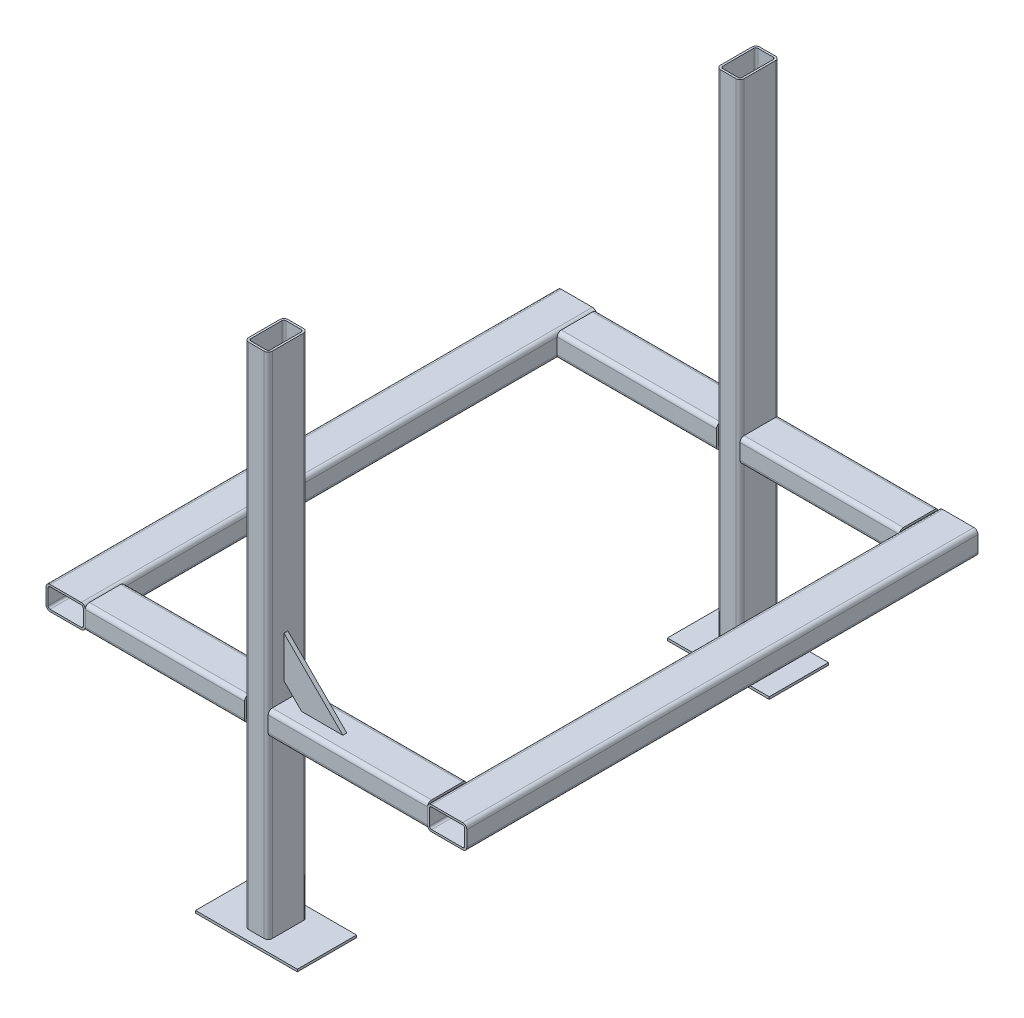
SolidWorks part; units mm, degrees
ref_plane "Front Plane" through (0, 0, 0) normal (0, 0, 1) x (1, 0, 0)
ref_plane "Top Plane" through (0, 0, 0) normal (0, 1, 0) x (1, 0, 0)
ref_plane "Right Plane" through (0, 0, 0) normal (1, 0, 0) x (0, 0, -1)
sketch "Sketch2"
extrude "Extrude1" add sketch "Sketch2" along normal blind 3
sketch "Sketch3"
other "Structural Member1"
ref_plane "Plane1" through (0, 0, 0) normal (0, 1, 0) x (-1, 0, 0)
sketch "Sketch1"
  dimension "D1" = 5.2
  dimension "D2" = 4.7625
  dimension "D3" = 6.604
  dimension "D4" = 41.275
  dimension "D5" = 41.275
  dimension "D6" = 4.7625
  dimension "D7" = 6.35
  dimension "D8" = 6.35
  dimension "Thickness" = 2.6
  dimension "V_leg" = 50
  dimension "H_leg" = 30
other "Structural Member2"
ref_plane "Plane3" through (-303.4274, 537.9257, 0) normal (1, 0, 0) x (0, 1, 0)
sketch "Sketch17"
  dimension "D1" = 5.2
  dimension "D2" = 4.7625
  dimension "D3" = 6.604
  dimension "D4" = 41.275
  dimension "D5" = 41.275
  dimension "D6" = 4.7625
  dimension "D7" = 6.35
  dimension "D8" = 6.35
  dimension "Thickness" = 2.6
  dimension "V_leg" = 50
  dimension "H_leg" = 30
ref_plane "Plane4" through (0, 0, 300) normal (0, 0, 1) x (1, 0, 0)
mirror "Mirror1"
ref_plane "Plane6" through (0, 241.8439, 0) normal (0, -1, 0) x (1, 0, 0)
sketch "Sketch18"
other "Structural Member3"
ref_plane "Plane5" through (-242.5049, 241.8439, -25) normal (0, 0, 1) x (1, 0, 0)
sketch "Sketch19"
  dimension "D1" = 5.2
  dimension "D2" = 4.7625
  dimension "D3" = 6.604
  dimension "D4" = 41.275
  dimension "D5" = 41.275
  dimension "D6" = 4.7625
  dimension "D7" = 6.35
  dimension "D8" = 6.35
  dimension "Thickness" = 2.6
  dimension "V_leg" = 50
  dimension "H_leg" = 30
other "Trim/Extend3"
other "Gusset1" parameters "D1"=5, "D2"=5, "D3"=0, "D4"=0, "D10"=5, "D11"=75, "D12"=75, "D13"=15, "D14"=46, "D15"=12.8682, "D16"=22.5, "D17"=22.5, "D18"=45
sketch "Sketch20"
